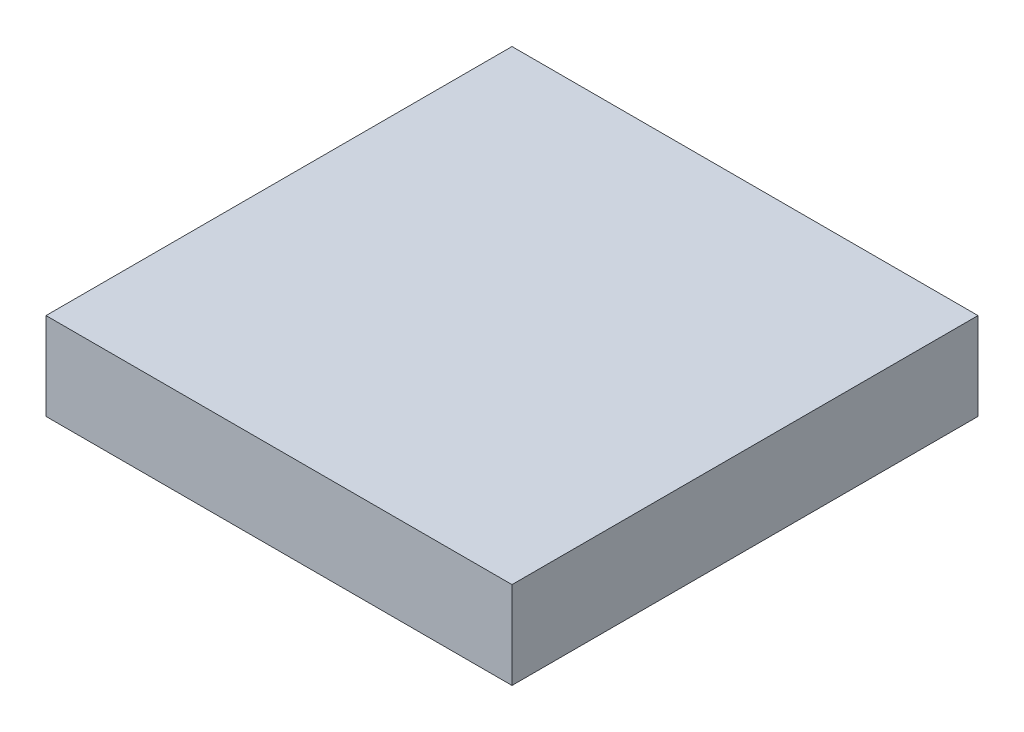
SolidWorks part; units mm, degrees
ref_plane "Front Plane" through (0, 0, 0) normal (0, 0, 1) x (1, 0, 0)
ref_plane "Top Plane" through (0, 0, 0) normal (0, 1, 0) x (1, 0, 0)
ref_plane "Right Plane" through (0, 0, 0) normal (1, 0, 0) x (0, 0, -1)
sketch "Sketch1" plane through (0, 0, 0) normal (0, 1, 0) x (1, 0, 0)
  line L1 (0, 0) -> (16, 0)
  line L2 (0, 0) -> (0, -16)
  line L3 (0, -16) -> (16, -16)
  line L4 (16, 0) -> (16, -16)
  dimension "D1" = 16
  dimension "D2" = 16
extrude "Boss-Extrude1" add sketch "Sketch1" along normal blind 3
